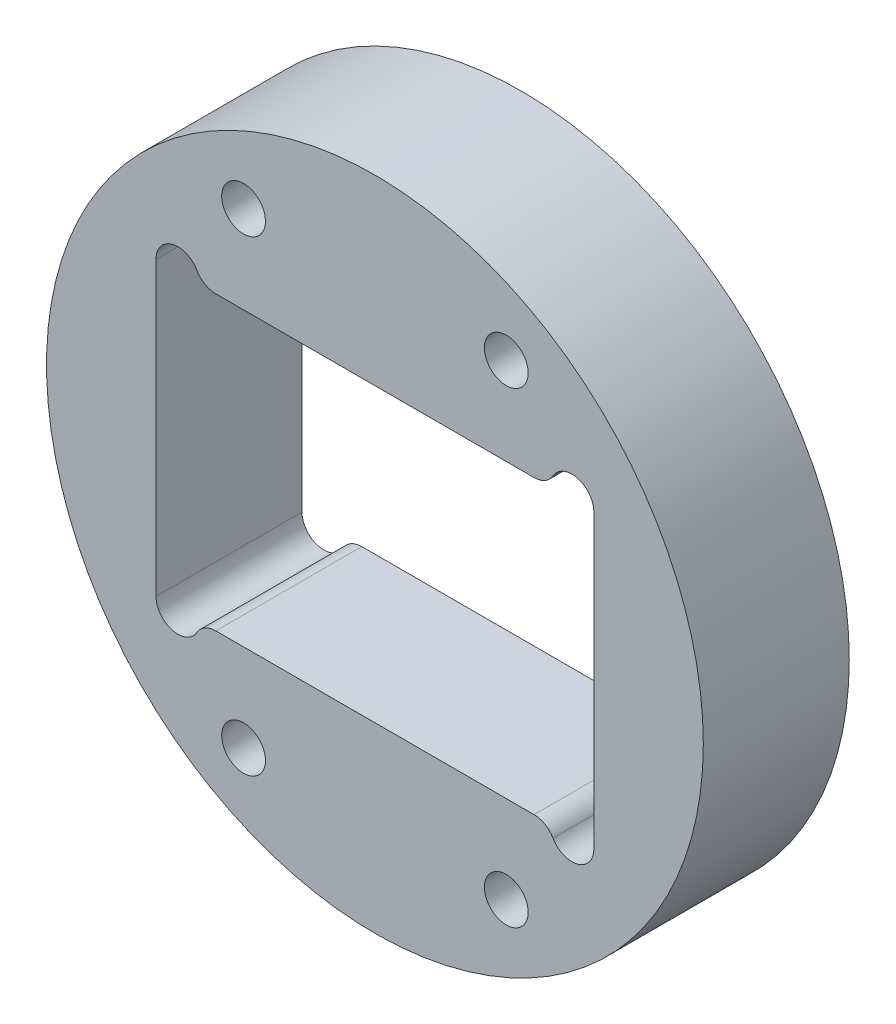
SolidWorks part; units mm, degrees
ref_plane "Plan de face" through (0, 0, 0) normal (0, 0, 1) x (1, 0, 0)
ref_plane "Plan de dessus" through (0, 0, 0) normal (0, 1, 0) x (1, 0, 0)
ref_plane "Plan de droite" through (0, 0, 0) normal (1, 0, 0) x (0, 0, -1)
sketch "Esquisse1" plane through (0, 0, 0) normal (0, 0, 1) x (1, 0, 0)
  line L0 (-47.0465, 30.0201) -> (-47.0465, 10.0201)
  line L1 (-51.1446, 10.0201) -> (-72.9484, 10.0201)
  line L2 (-77.0465, 10.0201) -> (-77.0465, 30.0201)
  line L3 (-72.9484, 30.0201) -> (-51.1446, 30.0201)
  arc A0 (-51.1446, 30.0201) -> (-49.8455, 30.7701) centre (-51.1446, 31.5201) ccw
  arc A1 (-47.0465, 30.0201) -> (-49.8455, 30.7701) centre (-48.5465, 30.0201) ccw
  arc A2 (-49.8455, 9.2701) -> (-47.0465, 10.0201) centre (-48.5465, 10.0201) ccw
  arc A3 (-49.8455, 9.2701) -> (-51.1446, 10.0201) centre (-51.1446, 8.5201) ccw
  arc A4 (-72.9484, 10.0201) -> (-74.2474, 9.2701) centre (-72.9484, 8.5201) ccw
  arc A5 (-77.0465, 10.0201) -> (-74.2474, 9.2701) centre (-75.5465, 10.0201) ccw
  arc A6 (-74.2474, 30.7701) -> (-77.0465, 30.0201) centre (-75.5465, 30.0201) ccw
  arc A7 (-74.2474, 30.7701) -> (-72.9484, 30.0201) centre (-72.9484, 31.5201) ccw
  circle A8 centre (-62.0465, 20.0201) radius 22.5
  circle A9 centre (-71.0465, 36.0201) radius 1.5
  circle A10 centre (-53.0465, 36.0201) radius 1.5
  circle A11 centre (-53.0465, 4.0201) radius 1.5
  circle A12 centre (-71.0465, 4.0201) radius 1.5
  dimension "D4" = 45
  dimension "D5" = 1.5
  dimension "D6" = 1.5
  dimension "D7" = 1.5
  dimension "D8" = 1.5
  dimension "D9" = 1.5
  dimension "D10" = 1.5
  dimension "D11" = 1.5
  dimension "D12" = 1.5
  dimension "D13" = 15
  dimension "D14" = 3
  dimension "D15" = 3
  dimension "D16" = 3
  dimension "D17" = 3
  dimension "D1" = 30
  dimension "D2" = 20
  dimension "D3" = 10
  dimension "D18" = 9
  dimension "D19" = 9
  dimension "D20" = 9
  dimension "D21" = 9
  dimension "D22" = 16
  dimension "D23" = 16
  dimension "D24" = 16
  dimension "D25" = 16
extrude "Boss.-Extru.1" add sketch "Esquisse1" along normal blind 10
